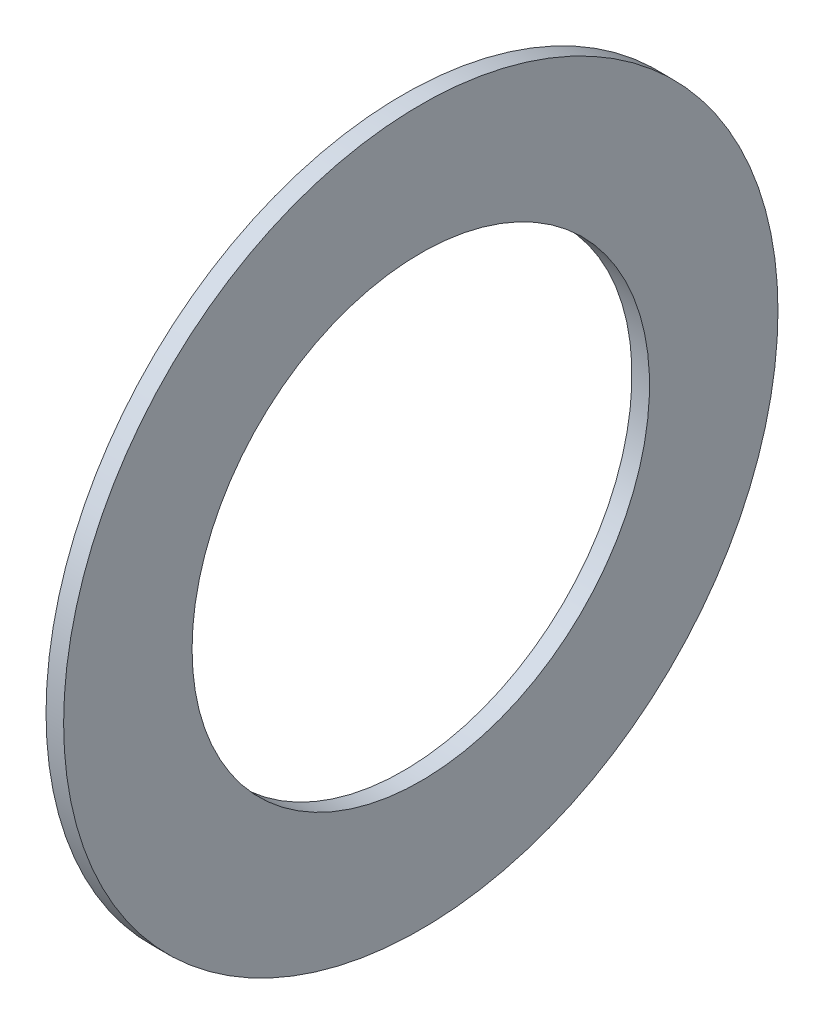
SolidWorks part; units mm, degrees
ref_plane "Face" through (0, 0, 0) normal (0, 0, 1) x (1, 0, 0)
ref_plane "Dessus" through (0, 0, 0) normal (0, 1, 0) x (1, 0, 0)
ref_plane "Droite" through (0, 0, 0) normal (1, 0, 0) x (0, 0, -1)
sketch "Esquisse1" plane through (0, 0, 0) normal (0, 0, 1) x (1, 0, 0)
  line L0 (-16.9214, 0) -> (18.889, 0) construction
  line L2 (0, 20.3) -> (-1, 20.3)
  line L3 (0, 20.3) -> (0, 13)
  line L4 (0, 13) -> (-1, 13)
  line L5 (-1, 20.3) -> (-1, 13)
  dimension "D1" = 26
  dimension "D2" = 40.6
  dimension "D3" = 1
revolve "Base-Révolution" add sketch "Esquisse1" angle 360 about L0
sketch "Esquisse2" plane through (0, 0, 0) normal (1, 0, 0) x (0, 0, -1)
  line L0 (0, 20.3) -> (0, -20.3)
  circle A0 centre (0, 0) radius 20.3 construction
  arc A1 (0, -20.3) -> (0, 20.3) centre (0, 0) ccw
extrude "COUPE" [suppressed] cut sketch "Esquisse2" against normal up to next
